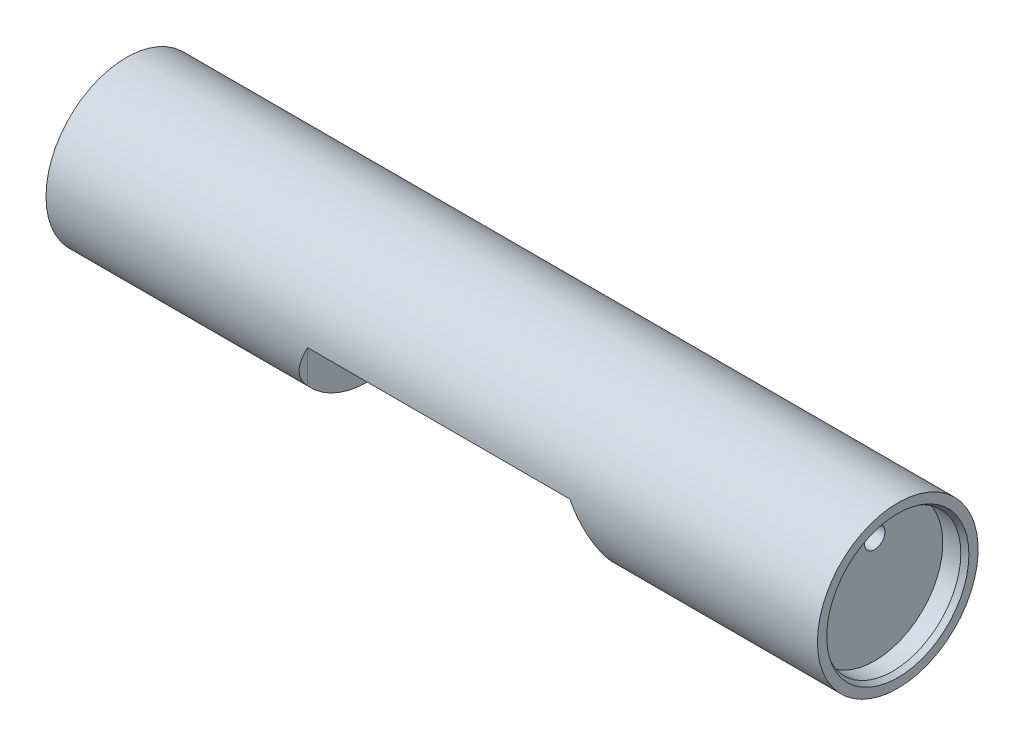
SolidWorks part; units mm, degrees
ref_plane "Plan de face" through (0, 0, 0) normal (0, 0, 1) x (1, 0, 0)
ref_plane "Plan de dessus" through (0, 0, 0) normal (0, 1, 0) x (1, 0, 0)
ref_plane "Plan de droite" through (0, 0, 0) normal (1, 0, 0) x (0, 0, -1)
sketch "Esquisse1" plane through (0, 0, 0) normal (1, 0, 0) x (0, 0, -1)
  circle A1 centre (0, 0) radius 17.5
  dimension "D2" = 35
extrude "Boss.-Extru.1" add sketch "Esquisse1" along normal blind 150
sketch "Esquisse2" plane through (0, 0, 0) normal (0, 0, 1) x (1, 0, 0)
  line L0 (0, 0) -> (150, 0) construction
  line L1 (150, -17.5) -> (150, 17.5) construction
  line L2 (0, 15.625) -> (0, 27.2771)
  line L3 (0, 17.5) -> (0, -17.5) construction
  line L4 (0, 15.625) -> (150, 15.625)
  line L5 (0, 27.2771) -> (150, 27.2771)
  line L6 (150, 27.2771) -> (150, 15.625)
  line L8 (0, 13.25) -> (5.5, 13.25)
  line L9 (0, 13.25) -> (0, 0)
  line L10 (0, 0) -> (5.5, 0)
  line L11 (5.5, 13.25) -> (5.5, 0)
  line L12 (150, 13.25) -> (145.5, 13.25)
  line L13 (150, 13.25) -> (150, 0)
  line L14 (150, 0) -> (145.5, 0)
  line L15 (145.5, 13.25) -> (145.5, 0)
  dimension "D1" = 31.25
  dimension "D2" = 5.5
  dimension "D3" = 26.5
  dimension "D4" = 4.5
revolve "Enlèvement de matière-Révolution1" cut sketch "Esquisse2" angle 360 about L0
sketch "Esquisse6" plane through (0, 0, 0) normal (0, 0, 1) x (1, 0, 0)
  line L1 (46.85, 0) -> (105.85, 0)
  line L2 (46.85, 0) -> (46.85, -16.625)
  line L3 (46.85, -16.625) -> (105.85, -16.625)
  line L4 (105.85, 0) -> (105.85, -16.625)
  line L10 (0, 15.625) -> (0, -15.625) construction
  dimension "D1" = 59
  dimension "D2" = 16.625
  dimension "D3" = 46.85
extrude "Enlèv. mat.-Extru.4" cut sketch "Esquisse6" against normal mid plane 40
hole_wizard "Trou taraudé M4x0.71" positions "Esquisse9" profile "Esquisse8" tap size "M4x0.7" standard "Ansi Metric"
sketch "Esquisse9" plane through (0, 0, 0) normal (0, -1, 0) x (1, 0, 0)
  line L0 (62.35, 0) -> (90.35, 0) construction
  line L6 (76.35, -15.625) -> (76.35, 0) construction
  line L7 (46.85, -15.625) -> (105.85, -15.625) construction
  point P0 (62.35, 0)
  point P1 (90.35, 0)
  dimension "D1" = 28
sketch "Esquisse8" plane through (62.35, 0, 0) normal (1, 0, 0) x (0, 0, -1)
  line L0 (0, 0) -> (0, 12.4914)
  line L1 (0, 12.4914) -> (1.65, 11.5)
  line L2 (1.65, 11.5) -> (1.65, 0)
  line L5 (1.65, 0) -> (0, 0)
  line L10 (0, 12.4914) -> (-1.65, 11.5) construction
  line L11 (0, -6.35) -> (0, 107.95) construction
  dimension "Diamètre du trou pour taraudage" = 3.3
  dimension "Profondeur du trou pour taraudage" = 11.5
  dimension "Angle de pointe" = 118
chamfer "Chanfrein1" distance 1 angle 30 2 edges at (0, 0, 13.25) (150, 0, 13.25)
hole_wizard "Diamètre du perçage Ø4.0 (4)1" positions "Esquisse12" profile "Esquisse10" hole size "Ø4.0" standard "ISO"
sketch "Esquisse12" plane through (5.5, 0, 0) normal (-1, 0, 0) x (0, 0, 1)
  line L0 (0, 7.5) -> (0, 0) construction
  point P0 (0, 7.5)
  dimension "D1" = 7.5
sketch "Esquisse10" plane through (5.5, 7.5, 0) normal (0, 1, 0) x (0, 0, 1)
  line L0 (0, 0) -> (0, 11.2017)
  line L1 (0, 11.2017) -> (2, 10)
  line L2 (2, 10) -> (2, 0)
  line L5 (2, 0) -> (0, 0)
  line L10 (0, 11.2017) -> (-2, 10) construction
  line L11 (0, -6.35) -> (0, 107.95) construction
  dimension "Diamètre du perçage" = 4
  dimension "Profondeur du perçage" = 10
  dimension "Angle de pointe" = 118
hole_wizard "Diamètre du perçage Ø4.0 (4)2" positions "Esquisse14" profile "Esquisse13" hole size "Ø4.0" standard "ISO"
sketch "Esquisse14" plane through (145.5, 0, 0) normal (1, 0, 0) x (0, 0, -1)
  point P0 (0, 7.5)
sketch "Esquisse13" plane through (145.5, 7.5, 0) normal (0, 1, 0) x (0, 0, -1)
  line L0 (0, 0) -> (0, 11.2017)
  line L1 (0, 11.2017) -> (2, 10)
  line L2 (2, 10) -> (2, 0)
  line L5 (2, 0) -> (0, 0)
  line L10 (0, 11.2017) -> (-2, 10) construction
  line L11 (0, -6.35) -> (0, 107.95) construction
  dimension "Diamètre du perçage" = 4
  dimension "Profondeur du perçage" = 10
  dimension "Angle de pointe" = 118
sketch "Esquisse15" plane through (0, 0, 0) normal (0, -1, 0) x (1, 0, 0)
  line L0 (105.85, 15.625) -> (46.85, 15.625) construction
  line L1 (46.85, -15.625) -> (46.85, 15.625) construction
  line L2 (46.85, -15.625) -> (105.85, -15.625) construction
  line L3 (105.85, -15.625) -> (105.85, 15.625) construction
  line L4 (105.85, 15.625) -> (101.85, 15.625)
  line L5 (46.85, -15.625) -> (46.85, -11.625)
  line L6 (46.85, -15.625) -> (50.85, -15.625)
  line L7 (105.85, -15.625) -> (105.85, -11.625)
  line L8 (50.85, 15.625) -> (46.85, 15.625)
  line L9 (46.85, 11.625) -> (46.85, 15.625)
  line L10 (101.85, -15.625) -> (105.85, -15.625)
  line L11 (105.85, 11.625) -> (105.85, 15.625)
  arc A0 (50.85, 15.625) -> (46.85, 11.625) centre (50.85, 11.625) ccw
  arc A1 (105.85, 11.625) -> (101.85, 15.625) centre (101.85, 11.625) ccw
  arc A2 (101.85, -15.625) -> (105.85, -11.625) centre (101.85, -11.625) ccw
  arc A3 (46.85, -11.625) -> (50.85, -15.625) centre (50.85, -11.625) ccw
  dimension "D1" = 8
extrude "Boss.-Extru.2" add sketch "Esquisse15" along normal up to surface (10.4403 mm away)
